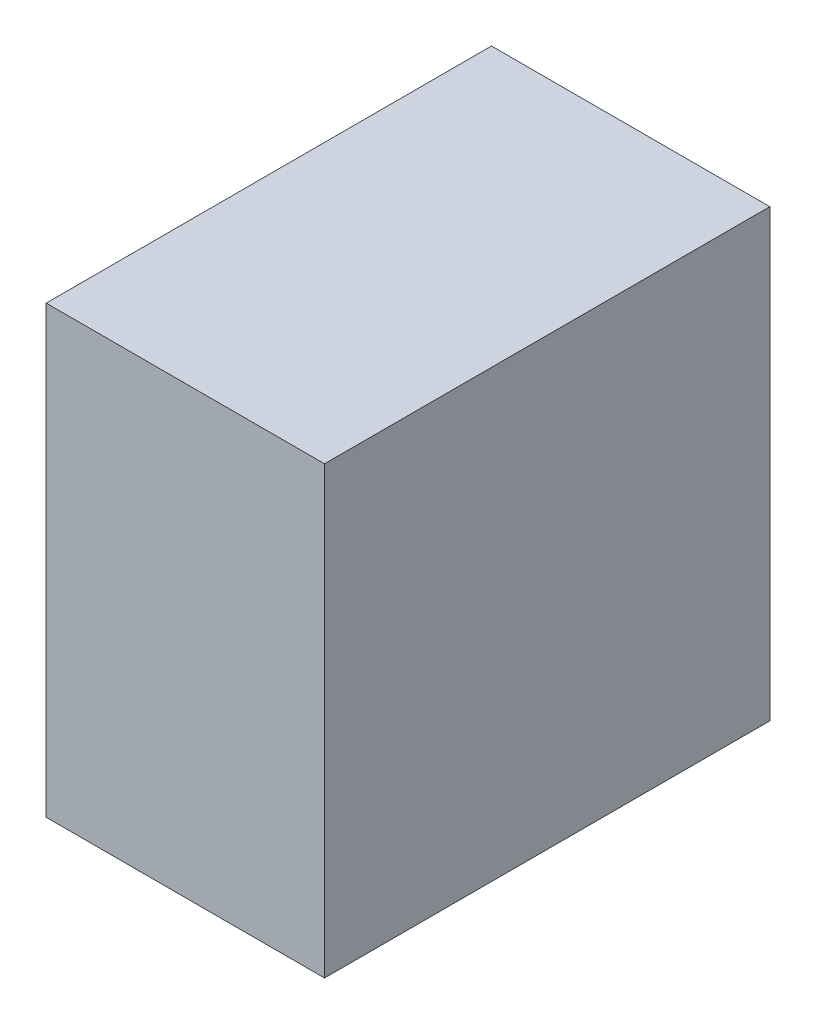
SolidWorks part; units mm, degrees
ref_plane "Front Plane" through (0, 0, 0) normal (0, 0, 1) x (1, 0, 0)
ref_plane "Top Plane" through (0, 0, 0) normal (0, 1, 0) x (1, 0, 0)
ref_plane "Right Plane" through (0, 0, 0) normal (1, 0, 0) x (0, 0, -1)
sketch "Sketch1" plane through (0, 0, 0) normal (1, 0, 0) x (0, 0, -1)
  line L1 (2, -2) -> (-2, -2)
  line L2 (2, -2) -> (2, 2)
  line L3 (2, 2) -> (-2, 2)
  line L4 (-2, -2) -> (-2, 2)
  line L5 (2, -2) -> (-2, 2) construction
  line L6 (2, 2) -> (-2, -2) construction
  point P0 (0, 0)
  point P6 (0, 0)
  dimension "D1" = 4
  dimension "D2" = 4
extrude "Boss-Extrude1" add sketch "Sketch1" along normal blind 2.5
sketch "Sketch3" plane through (0, 0, 0) normal (-1, 0, 0) x (0, 0, 1)
  line L1 (-1, 1) -> (1, 1)
  line L2 (-1, 1) -> (-1, -1)
  line L3 (-1, -1) -> (1, -1)
  line L4 (1, 1) -> (1, -1)
  line L5 (-1, 1) -> (1, -1) construction
  line L6 (-1, -1) -> (1, 1) construction
  point P0 (0, 0)
  dimension "D2" = 2
  dimension "D3" = 2
extrude "Cut-Extrude2" cut sketch "Sketch3" against normal blind 1
